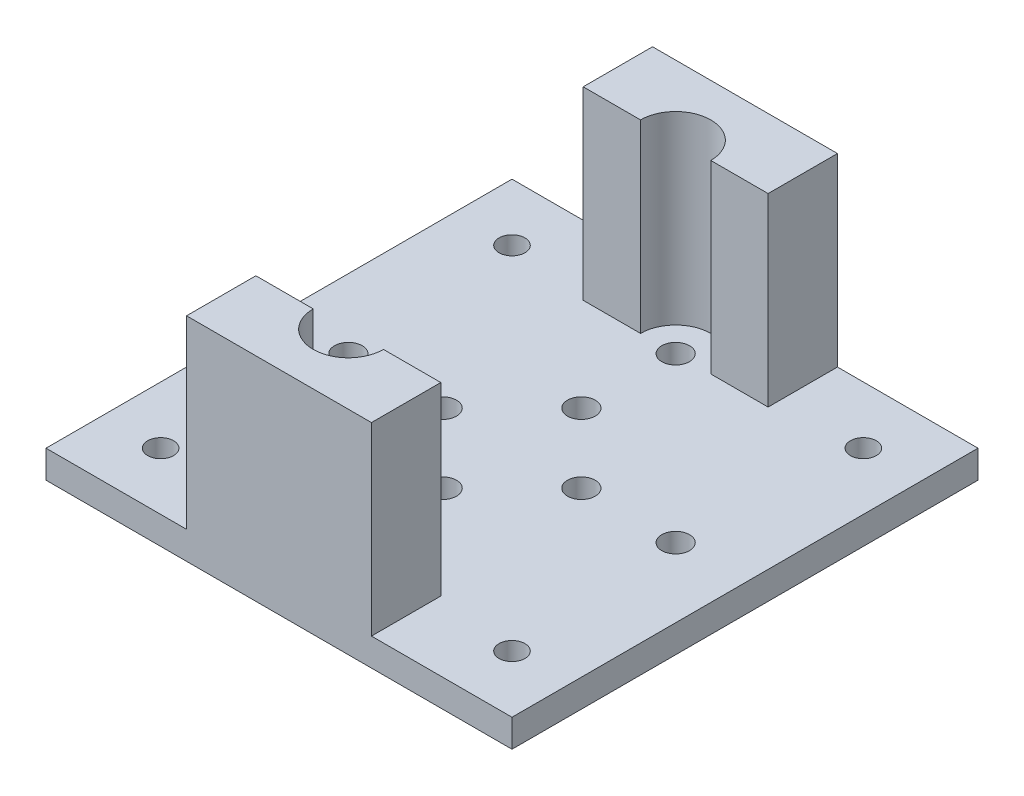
SolidWorks part; units mm, degrees
ref_plane "前视基准面" through (0, 0, 0) normal (0, 0, 1) x (1, 0, 0)
ref_plane "上视基准面" through (0, 0, 0) normal (0, 1, 0) x (1, 0, 0)
ref_plane "右视基准面" through (0, 0, 0) normal (1, 0, 0) x (0, 0, -1)
sketch "草图2" plane through (0, 0, 0) normal (0, 1, 0) x (1, 0, 0)
  line L0 (0, 82.3651) -> (0, -61.7315) construction
  line L1 (-25.2, 25.2) -> (25.2, 25.2)
  line L2 (-25.2, 25.2) -> (-25.2, -25.2)
  line L3 (-25.2, -25.2) -> (25.2, -25.2)
  line L4 (25.2, 25.2) -> (25.2, -25.2)
  line L5 (-25.2, 25.2) -> (25.2, -25.2) construction
  line L6 (-25.2, -25.2) -> (25.2, 25.2) construction
  line L7 (-92.1745, 0) -> (112.4698, 0) construction
  point P0 (0, 0)
  dimension "D1" = 50.4
  dimension "D2" = 50.4
extrude "凸台-拉伸1" add sketch "草图2" against normal blind 3
sketch "草图3" plane through (0, 0, 0) normal (0, 1, 0) x (1, 0, 0)
  line L0 (-31.4477, 0) -> (38.2819, 0) construction
  line L1 (0, 26.7492) -> (0, -28.5646) construction
  circle A0 centre (0, 17.7) radius 1.5
  circle A2 centre (17.7, 0) radius 1.5
  circle A3 centre (0, -17.7) radius 1.5
  circle A4 centre (-17.7, 0) radius 1.5
  point P16 (0, 0)
  dimension "D1" = 3
  dimension "D2" = 17.7
  dimension "D3" = 4
extrude "切除-拉伸1" cut sketch "草图3" against normal through all and the other way through all
sketch "草图4" plane through (0, 0, 0) normal (0, 1, 0) x (1, 0, 0)
  line L0 (-46.7177, 0) -> (39.2429, 0) construction
  line L1 (0, 26.6425) -> (0, -30.0595) construction
  circle A0 centre (-19, 19) radius 1.4
  circle A1 centre (19, 19) radius 1.4
  circle A2 centre (19, -19) radius 1.4
  circle A3 centre (-19, -19) radius 1.4
  point P16 (0, 0)
  dimension "D1" = 2.8
  dimension "D2" = 19
  dimension "D3" = 19
  dimension "D4" = 4
extrude "切除-拉伸2" cut sketch "草图4" against normal through all
sketch "草图6" plane through (0, 0, 0) normal (0, 1, 0) x (1, 0, 0)
  line L0 (0, 54.1326) -> (0, -44.8791) construction
  line L1 (-61.4686, 0) -> (76.0475, 0) construction
  line L2 (25.2, 25.2) -> (-25.2, 25.2) construction
  line L3 (10, 17.7) -> (3.8, 17.7)
  line L4 (10, 17.7) -> (10, 25.2)
  line L5 (10, 25.2) -> (-10, 25.2)
  line L6 (-10, 17.7) -> (-10, 25.2)
  line L7 (10, 17.7) -> (-10, 25.2) construction
  line L8 (10, 25.2) -> (-10, 17.7) construction
  line L9 (-3.8, 17.7) -> (-10, 17.7)
  line L10 (10, -17.7) -> (3.8, -17.7)
  line L11 (10, -17.7) -> (10, -25.2)
  line L12 (10, -25.2) -> (-10, -25.2)
  line L13 (-10, -17.7) -> (-10, -25.2)
  line L14 (-3.8, -17.7) -> (-10, -17.7)
  circle A0 centre (-19, 19) radius 1.4 construction
  circle A1 centre (-19, 19) radius 1.4 construction
  circle A2 centre (-19, 19) radius 6 construction
  circle A3 centre (0, 17.7) radius 1.5 construction
  circle A4 centre (0, 17.7) radius 1.5 construction
  arc A5 (3.8, 17.7) -> (-3.8, 17.7) centre (0, 17.7) ccw
  arc A6 (3.8, -17.7) -> (-3.8, -17.7) centre (0, -17.7) cw
  point P13 (0, 21.45)
  dimension "D1" = 12
  dimension "D2" = 7.6
  dimension "D3" = 20
  dimension "D4" = 7.5
extrude "凸台-拉伸2" add sketch "草图6" along normal blind 20
sketch "草图7" plane through (0, 0, 0) normal (0, 1, 0) x (1, 0, 0)
  line L0 (0, 41.0775) -> (0, -39.4084) construction
  line L1 (-47.5683, 0) -> (52.39, 0) construction
  circle A0 centre (0, 7.5) radius 1.5
  circle A2 centre (7.5, 0) radius 1.5
  circle A3 centre (0, -7.5) radius 1.5
  circle A4 centre (-7.5, 0) radius 1.5
  point P16 (0, 0)
  dimension "D1" = 3
  dimension "D2" = 7.5
  dimension "D3" = 4
extrude "切除-拉伸3" cut sketch "草图7" against normal blind 10
